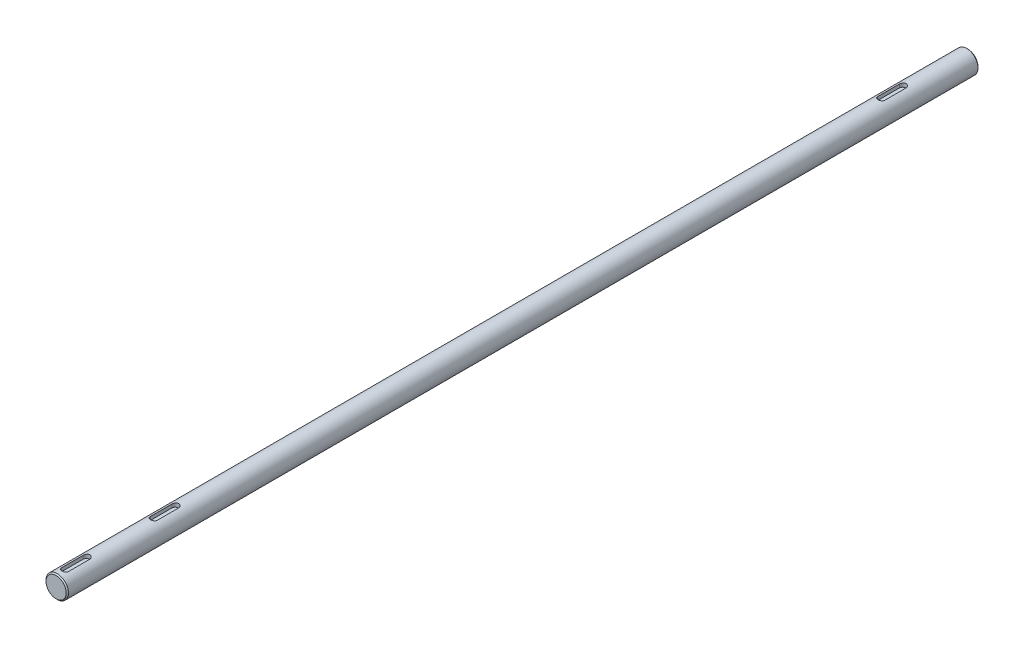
SolidWorks part; units mm, degrees
ref_plane "Plan de face" through (0, 0, 0) normal (0, 0, 1) x (1, 0, 0)
ref_plane "Plan de dessus" through (0, 0, 0) normal (0, 1, 0) x (1, 0, 0)
ref_plane "Plan de droite" through (0, 0, 0) normal (1, 0, 0) x (0, 0, -1)
sketch "Esquisse1" plane through (0, 0, 0) normal (0, 0, 1) x (1, 0, 0)
  circle A0 centre (0, 0) radius 10
  dimension "D1" = 20
extrude "Extrusion1" add sketch "Esquisse1" along normal mid plane 811
chamfer "Chanfrein1" distance 1 angle 45 2 edges at (10, 0, -405.5) (10, 0, 405.5)
sketch "Esquisse2" plane through (-6.6844, -26.5465, 405.5) normal (0, 0, 1) x (1, 0, 0)
  line L0 (6.6844, 33.5465) -> (6.6844, 36.5465)
  line L1 (6.6844, 36.5465) -> (16.6844, 36.5465)
  circle A0 centre (6.6844, 26.5465) radius 10 construction
  dimension "D1" = 3
  dimension "D2" = 10
ref_plane "Plan1" through (0, 10, 405.5) normal (0, 1, 0) x (1, 0, 0)
sketch "Esquisse11" plane through (0, 10, 405.5) normal (0, 1, 0) x (-1, 0, 0)
  line L0 (-3, -8) -> (-3, -27)
  line L1 (3, -27) -> (3, -8)
  line L9 (9, 0) -> (-9, 0) construction
  arc A0 (-3, -27) -> (3, -27) centre (0, -27) ccw
  arc A1 (3, -8) -> (-3, -8) centre (0, -8) ccw
  dimension "D1" = 25
  dimension "D3" = 5
  dimension "D2" = 6
extrude "Enlèv. mat.-Extru.2" cut sketch "Esquisse11" against normal blind 3.5
other "rainure clavette <1>"
sketch "Esquisse22" plane through (-3.518, -22.2286, 405.5) normal (0, 0, 1) x (1, 0, 0)
  line L0 (3.518, 29.2286) -> (3.518, 32.2286)
  line L1 (3.518, 32.2286) -> (13.518, 32.2286)
  circle A0 centre (3.518, 22.2286) radius 10 construction
  dimension "D1" = 3
  dimension "D2" = 10
ref_plane "Plan12" through (0, 10, 405.5) normal (0, 1, 0) x (1, 0, 0)
sketch "Esquisse12" plane through (0, 10, 405.5) normal (0, 1, 0) x (-1, 0, 0)
  line L0 (-3, -87) -> (-3, -106)
  line L1 (3, -106) -> (3, -87)
  line L6 (9, 0) -> (-9, 0) construction
  arc A0 (-3, -106) -> (3, -106) centre (0, -106) ccw
  arc A1 (3, -87) -> (-3, -87) centre (0, -87) ccw
  dimension "D1" = 25
  dimension "D3" = 84
  dimension "D2" = 6
extrude "Enlèv. mat.-Extru.22" cut sketch "Esquisse12" against normal blind 3.5
other "rainure clavette <2>"
sketch "Esquisse23" plane through (3.9807, -26.6539, -405.5) normal (0, 0, -1) x (-1, 0, 0)
  line L0 (3.9807, 33.6539) -> (3.9807, 36.6539)
  line L1 (3.9807, 36.6539) -> (13.9807, 36.6539)
  circle A0 centre (3.9807, 26.6539) radius 10 construction
  dimension "D1" = 3
  dimension "D2" = 10
ref_plane "Plan13" through (0, 10, -405.5) normal (0, 1, 0) x (1, 0, 0)
sketch "Esquisse13" plane through (0, 10, -405.5) normal (0, 1, 0) x (1, 0, 0)
  line L0 (-3, -58) -> (-3, -77)
  line L1 (3, -77) -> (3, -58)
  line L7 (9, 0) -> (-9, 0) construction
  arc A0 (-3, -77) -> (3, -77) centre (0, -77) ccw
  arc A1 (3, -58) -> (-3, -58) centre (0, -58) ccw
  dimension "D1" = 25
  dimension "D3" = 55
  dimension "D2" = 6
extrude "Enlèv. mat.-Extru.23" cut sketch "Esquisse13" against normal blind 3.5
other "rainure clavette <3>"
